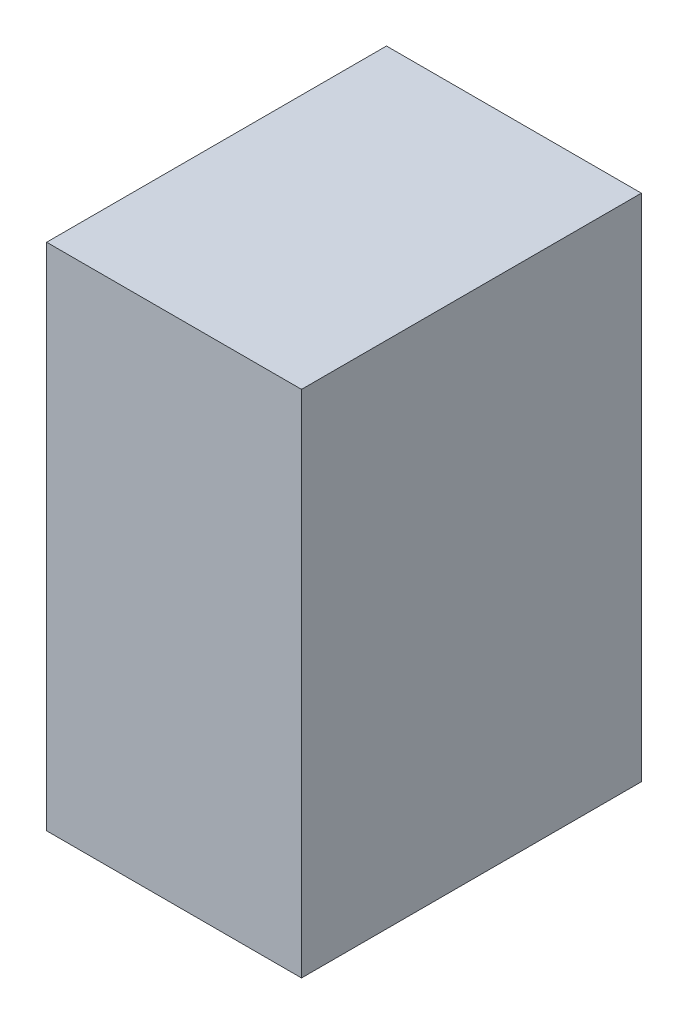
SolidWorks part; units mm, degrees
ref_plane "Front Plane" through (0, 0, 0) normal (0, 0, 1) x (1, 0, 0)
ref_plane "Top Plane" through (0, 0, 0) normal (0, 1, 0) x (1, 0, 0)
ref_plane "Right Plane" through (0, 0, 0) normal (1, 0, 0) x (0, 0, -1)
sketch "Sketch1" plane through (0, 0, 0) normal (0, 1, 0) x (1, 0, 0)
  line L0 (-37.5, -50) -> (37.5, 50) construction
  line L1 (-37.5, 50) -> (37.5, 50)
  line L2 (-37.5, 50) -> (-37.5, -50)
  line L3 (-37.5, -50) -> (37.5, -50)
  line L4 (37.5, 50) -> (37.5, -50)
  dimension "D1" = 75
  dimension "D2" = 100
extrude "Extrude1" add sketch "Sketch1" along normal blind 150
